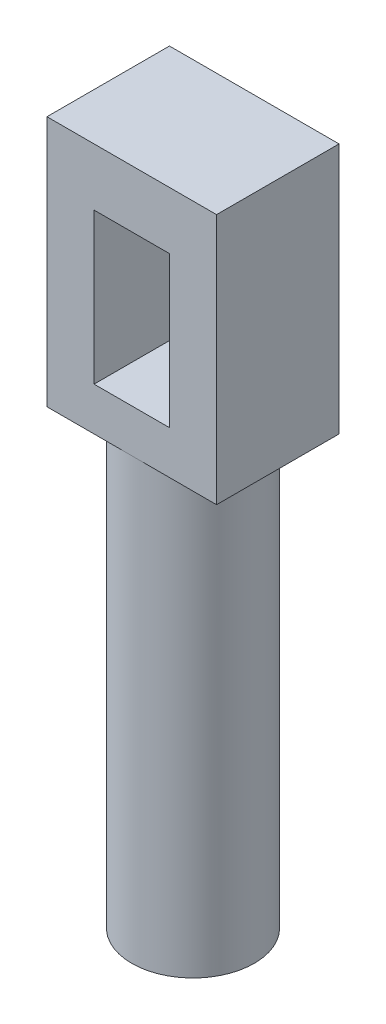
SolidWorks part; units mm, degrees
ref_plane "Front Plane" through (0, 0, 0) normal (0, 0, 1) x (1, 0, 0)
ref_plane "Top Plane" through (0, 0, 0) normal (0, 1, 0) x (1, 0, 0)
ref_plane "Right Plane" through (0, 0, 0) normal (1, 0, 0) x (0, 0, -1)
sketch "Sketch1" plane through (0, 0, 0) normal (0, 1, 0) x (1, 0, 0)
  circle A0 centre (0, 0) radius 9.75
extrude "Boss-Extrude1" add sketch "Sketch1" along normal blind 70
sketch "Sketch3" plane through (0, 70, 0) normal (0, 1, 0) x (1, 0, 0)
  line L1 (-13.5, 9.75) -> (13.5, 9.75)
  line L2 (-13.5, 9.75) -> (-13.5, -9.75)
  line L3 (-13.5, -9.75) -> (13.5, -9.75)
  line L4 (13.5, 9.75) -> (13.5, -9.75)
  line L5 (-13.5, 9.75) -> (13.5, -9.75) construction
  line L6 (-13.5, -9.75) -> (13.5, 9.75) construction
  point P0 (0, 0)
extrude "Boss-Extrude3" add sketch "Sketch3" along normal blind 40
sketch "Sketch4" plane through (0, 0, -9.75) normal (0, 0, -1) x (-1, 0, 0)
  line L0 (0, 110) -> (0, 88.8755) construction
  line L2 (-13.5, 110) -> (13.5, 110) construction
  line L4 (-6, 100.8755) -> (6, 100.8755)
  line L5 (-6, 100.8755) -> (-6, 76.8755)
  line L6 (-6, 76.8755) -> (6, 76.8755)
  line L7 (6, 100.8755) -> (6, 76.8755)
  line L8 (-6, 100.8755) -> (6, 76.8755) construction
  line L9 (-6, 76.8755) -> (6, 100.8755) construction
extrude "Cut-Extrude1" cut sketch "Sketch4" against normal blind 40
